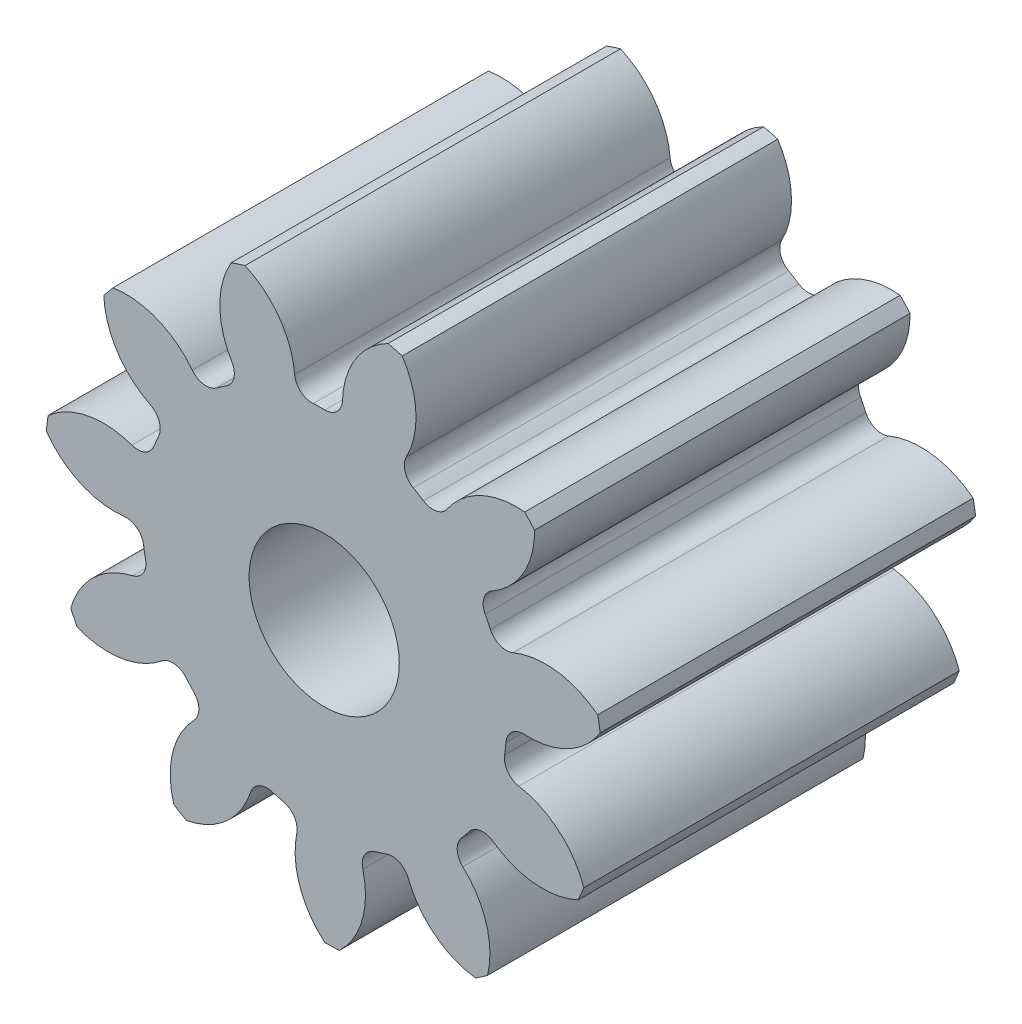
SolidWorks part; units mm, degrees
ref_plane "Front" through (0, 0, 0) normal (0, 0, 1) x (1, 0, 0)
ref_plane "Top" through (0, 0, 0) normal (0, 1, 0) x (1, 0, 0)
ref_plane "Right" through (0, 0, 0) normal (1, 0, 0) x (0, 0, -1)
sketch "Sketch3" plane through (0, 0, 0) normal (0, 0, 1) x (1, 0, 0)
  circle A0 centre (0, 0) radius 66.04
  dimension "od" = 132.08
extrude "gearBody" add sketch "Sketch3" along normal blind 88.9
sketch "Sketch2" plane through (0, 0, 0) normal (0, 0, 1) x (1, 0, 0)
  line L0 (0, 0) -> (48.5129, 20.0947) construction
  line L1 (61.8799, -25.4398) -> (0, 0) construction
  line L2 (0, 0) -> (36.3143, 0) construction
  line L3 (55.8563, 1.6268) -> (54.028, -14.2669) construction
  line L5 (54.9422, -6.32) -> (0, 0) construction
  line L7 (0, 0) -> (52.51, 0) construction
  arc A0 (52.5063, 0.6257) -> (50.9928, -12.5313) centre (0, 0) ccw construction
  arc A1 (65.3484, 9.5327) -> (61.4771, -24.1215) centre (0, 0) ccw construction
  arc A2 (55.8563, 1.6268) -> (54.028, -14.2669) centre (0, 0) ccw construction
  arc A3 (42.7141, -6.3262) -> (43.0348, -3.5376) centre (0, 0) ccw
  arc A4 (61.8799, -25.4398) -> (46.0947, -11.0058) centre (42.6832, -30.5851) ccw
  arc A5 (61.8799, -25.4398) -> (66.04, 10.7251) centre (0, 0) ccw
  arc A6 (66.04, 10.7251) -> (47.3898, 0.2522) centre (48.5129, 20.0947) cw
  arc A7 (43.0348, -3.5376) -> (47.3898, 0.2522) centre (47.1561, -3.8763) cw
  arc A8 (46.0947, -11.0058) -> (42.7141, -6.3262) centre (46.8046, -6.932) cw
  point P6 (66.04, 10.7251)
  point P22 (61.8799, -25.4398)
  dimension "baseDia" = 105.02
  dimension "od" = 132.08
  dimension "pd" = 111.76
  dimension "rd" = 86.36
  dimension "rFillet" = 4.1351
  dimension "pointX" = 66.04
  dimension "pointY" = 10.7251
  dimension "CTT" = 15.8937
  dimension "flankCenterAngle" = 22.5
extrude "toothCut" cut sketch "Sketch2" along normal through all
pattern_circular "CirPattern1" count 11 over 360 about axis through (0, 0, 0) along (0, 0, 1) of "toothCut"
sketch "hub1Dia" plane through (0, 0, 0) normal (0, 0, -1) x (-1, 0, 0)
  circle A0 centre (0, 0) radius 12.7
  dimension "hub1Dia" = 25.4
sketch "hub2Dia" plane through (0, 0, 88.9) normal (0, 0, 1) x (1, 0, 0)
  circle A0 centre (0, 0) radius 12.7
  dimension "hub2dia" = 25.4
sketch "boreDia" plane through (0, 0, 0) normal (0, 0, 1) x (1, 0, 0)
  circle A0 centre (0, 0) radius 17.78
  dimension "boreDia" = 35.56
extrude "bore" cut sketch "boreDia" against normal mid plane 25400
